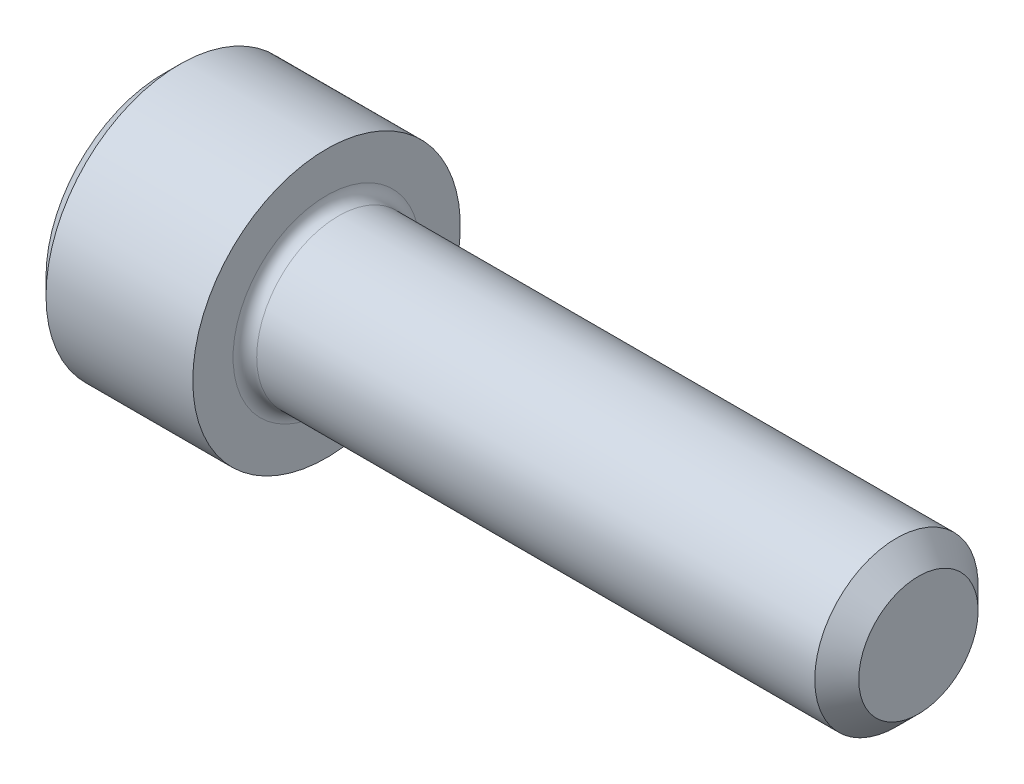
SolidWorks part; units mm, degrees
ref_plane "Plane1" through (0, 0, 0) normal (0, 0, 1) x (1, 0, 0)
ref_plane "Plane2" through (0, 0, 0) normal (0, 1, 0) x (1, 0, 0)
ref_plane "Plane3" through (0, 0, 0) normal (1, 0, 0) x (0, 0, -1)
revolve "Base-Revolve" add sketch "BodySke"
sketch "BodySke" plane through (0, 0, 0) normal (0, 0, 1) x (1, 0, 0)
  line L0 (0, 0) -> (0, 2.5146)
  line L1 (0.3556, 2.8702) -> (3.5052, 2.8702)
  line L2 (3.5052, 2.8702) -> (3.5052, 1.7526)
  line L3 (3.5052, 1.7526) -> (15.7328, 1.7526)
  line L4 (16.2052, 1.2802) -> (16.2052, 0)
  line L5 (16.2052, 0) -> (0, 0)
  line L6 (-31.75, 0) -> (127, 0) construction
  line L7 (0, 2.5146) -> (0.3556, 2.8702)
  line L8 (16.2052, 1.2802) -> (15.7328, 1.7526)
  line L9 (0, -2.5146) -> (0.3556, -2.8702) construction
  line L10 (16.2052, -1.2802) -> (15.7328, -1.7526) construction
  line L11 (4.2977, 9.525) -> (4.2977, 3.175) construction
  line L12 (3.5052, 9.525) -> (3.5052, 3.175) construction
  line L13 (-21.8948, 9.525) -> (-21.8948, 3.175) construction
  dimension "Diameter" = 3.5052
  dimension "Head_ht" = 3.5052
  dimension "Length" = 12.7
  dimension "Body_ch_ang" = 45
  dimension "Head_dia" = 5.7404
  dimension "Head_ch_ang" = 45
  dimension "Head_side_ht" = 3.1496
  dimension "Minor_dia" = 2.5603
  dimension "Advance" = 0.7925
  dimension "Thread_nom" = 12.7
  dimension "Thread_length" = 38.1
fillet "Fillet1" radius 0.254 1 edges at (3.5052, 0, 1.7526)
sketch "Sketch2" plane through (0, 0, 0) normal (0, 0, 1) x (1, 0, 0)
  line L0 (0, 1.3843) -> (1.6256, 1.3843)
  line L1 (1.6256, 1.3843) -> (2.4248, 0)
  line L2 (-31.75, 0) -> (127, 0) construction
  line L3 (2.4248, 0) -> (0, 0)
  line L4 (0, 0) -> (0, 1.3843)
  line L5 (0, 2.5146) -> (0, -2.5146) construction
  line L6 (0, 0) -> (47.625, 0) construction
  line L7 (3.5052, -2.8702) -> (3.5052, 2.8702) construction
  dimension "D1" = 1.3843
  dimension "D2" = 60
  dimension "Wall_thickness" = 1.8796
revolve "Hex-PreBroach" cut sketch "Sketch2" angle 360 about L6
sketch "Sketch3" plane through (0, 0, 0) normal (-1, 0, 0) x (0, 0.5, 0.866)
  line L0 (0.7992, 1.3843) -> (-0.7992, 1.3843)
  line L1 (-0.7992, 1.3843) -> (-1.5985, 0)
  line L2 (0.7992, 1.3843) -> (1.5985, 0)
  line L3 (0.7992, -1.3843) -> (1.5985, 0)
  line L4 (0.7992, -1.3843) -> (-0.7992, -1.3843)
  line L5 (-0.7992, -1.3843) -> (-1.5985, 0)
  dimension "D1" = 1.3843
  dimension "D2" = 1.3843
  dimension "Hex_size" = 2.7686
extrude "Hex" cut sketch "Sketch3" against normal blind 1.6256
sketch "Sketch4" plane through (0, 0, 0) normal (-1, 0, 0) x (0, 0, 1)
  line L0 (0, 0) -> (1.7399, 0)
  line L1 (0, 0) -> (6.1484, 3.5498) construction
  line L2 (0, 0) -> (0.8699, 1.5068)
  line L3 (1.4457, 0.3947) -> (1.6607, 0.5189)
  line L4 (1.0647, 1.0546) -> (1.2797, 1.1788)
  arc A0 (1.4457, 0.3947) -> (1.0647, 1.0546) centre (0, 0) ccw
  arc A1 (1.7399, 0) -> (1.6607, 0.5189) centre (0, 0) ccw
  arc A2 (0.8699, 1.5068) -> (1.2797, 1.1788) centre (0, 0) cw
  dimension "D1" = 30
  dimension "Spline_n_dim" = 2.9972
  dimension "Spline_m_dim" = 3.4798
  dimension "D2" = 60
  dimension "D3" = 0.381
  dimension "Spline_p_dim" = 0.762
extrude "Spline" [suppressed] cut sketch "Sketch4" against normal blind 1.6256
pattern_circular "CirPattern1" [suppressed] count 6 every 60
sketch "Sketch5" plane through (0, 0, 0) normal (0, 0, 1) x (1, 0, 0)
  line L0 (-31.75, 0) -> (127, 0) construction
  line L2 (0, 2.5146) -> (0, -2.5146) construction
  circle A0 centre (1.27, 0) radius 0.4445
  dimension "Drilled_hole_dia" = 0.889
  dimension "Drilled_hole_loc" = 1.27
extrude "Hole" [suppressed] cut sketch "Sketch5" against normal through all and the other way through all
pattern_circular "Drilled-4" [suppressed] count 2 every 60
pattern_circular "Drilled-6" [suppressed] count 3 every 60
sketch "ThdSchSke" plane through (0, 0, 0) normal (0, 0, 1) x (1, 0, 0)
  line L0 (4.2977, -1.2802) -> (3.9669, -1.7526)
  line L1 (4.2977, -1.2802) -> (4.6285, -1.7526)
  line L2 (4.6285, -1.7526) -> (4.6285, -2.1908)
  line L3 (-3.175, 0) -> (5.1513, 0) construction
  line L5 (4.6285, -2.1908) -> (3.9669, -2.1908)
  line L6 (3.9669, -2.1908) -> (3.9669, -1.7526)
  line L7 (0, 2.5146) -> (0, -2.5146) construction
  dimension "Thread_minor" = 2.5603
  dimension "Diameter" = 3.5052
  dimension "Start" = 4.2977
  dimension "SideAngle" = 55
  dimension "VeeAngle" = 70
  dimension "Overcut" = 4.3815
revolve "ThreadSchematic" [suppressed] cut sketch "ThdSchSke" angle 360 about L3
pattern_linear "ThdSchPat" [suppressed]
equation "\"D2@Sketch3\" = \"Hex_size@Sketch3\" / 2"
equation "\"D1@Sketch3\" = \"Hex_size@Sketch3\" / 2"
equation "\"D1@Sketch2\" = \"Hex_size@Sketch3\" / 2"
equation "\"D3@Sketch4\" = \"Spline_p_dim@Sketch4\" / 2"
equation "\"Thread_minor@ThreadCosmetic\"  =  \"Minor_dia@BodySke\""
equation "\"D2@CirPattern1\" = 360 / \"Num_teeth@CirPattern1\""
equation "\"Wall_thickness@Sketch2\" = \"Head_ht@BodySke\" - \"Key_eng@Hex\""
equation "\"Thread_length@ThreadCosmetic\" = ((sgn( (\"Length@BodySke\" - \"Advance@BodySke\" ) - \"Thread_nom@BodySke\" )-1)*( (\"Length@BodySke\" - \"Advance@BodySke\" ) - \"Thread_nom@BodySke\" ))/-2+ \"Thread_nom@BodySke\""
equation "\"Thread_minor@ThdSchSke\" = \"Minor_dia@BodySke\""
equation "\"Diameter@ThdSchSke\" = \"Diameter@BodySke\""
equation "\"Overcut@ThdSchSke\" = \"Diameter@BodySke\" * 1.25"
equation "\"Start@ThdSchSke\" = \"Head_ht@BodySke\" + \"Length@BodySke\" - \"Thread_length@ThreadCosmetic\"  '---Non-countersunk---"
equation "\"Num_threads@ThdSchPat\" = int( \"Thread_length@ThreadCosmetic\" / \"Advance@BodySke\" + 0.999 )  + 1"
equation "\"Advance@ThdSchPat\" = \"Thread_length@ThreadCosmetic\" /  (\"Num_threads@ThdSchPat\" - 1) 'relax it"
equation "\"Num_threads@ThdSchPat\" = \"Num_threads@ThdSchPat\" - sgn( \"Num_threads@ThdSchPat\" - 1) '---chamfered tips only---"
